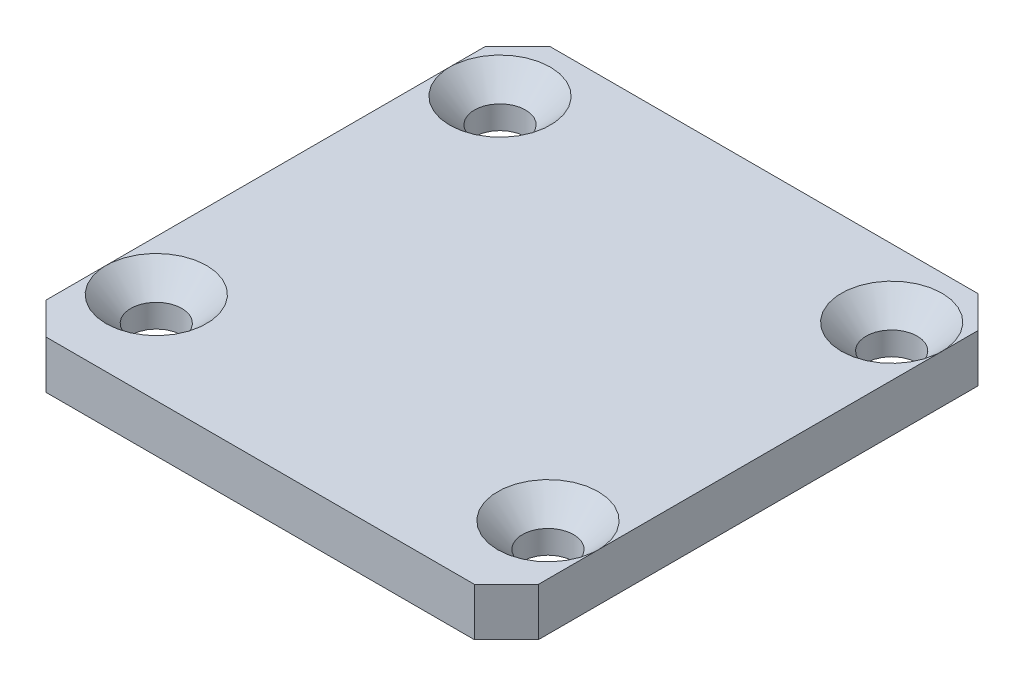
SolidWorks part; units mm, degrees
ref_plane "Front Plane" through (0, 0, 0) normal (0, 0, 1) x (1, 0, 0)
ref_plane "Top Plane" through (0, 0, 0) normal (0, 1, 0) x (1, 0, 0)
ref_plane "Right Plane" through (0, 0, 0) normal (1, 0, 0) x (0, 0, -1)
sketch "Sketch1" plane through (0, 0, 0) normal (0, 1, 0) x (1, 0, 0)
  line L1 (15.4, -15.75) -> (-15.4, -15.75)
  line L2 (15.4, -15.75) -> (15.4, 15.75)
  line L3 (15.4, 15.75) -> (-15.4, 15.75)
  line L4 (-15.4, -15.75) -> (-15.4, 15.75)
  line L5 (15.4, -15.75) -> (-15.4, 15.75) construction
  line L6 (15.4, 15.75) -> (-15.4, -15.75) construction
  point P0 (0, 0)
  dimension "D1" = 30.8
  dimension "D2" = 31.5
extrude "Boss-Extrude1" add sketch "Sketch1" along normal blind 3
chamfer "Chamfer1" distance 2 angle 45 4 edges at (-15.4, 1.5, -15.75) (15.4, 1.5, -15.75) (15.4, 1.5, 15.75) (-15.4, 1.5, 15.75)
hole_wizard "CSK for M3 Flat Head Machine Screw1" positions "Sketch11" profile "Sketch10" countersink size "M3" standard "ANSI Metric"
sketch "Sketch11" plane through (16.1594, 3, 3.7896) normal (0, 1, 0) x (-1, 0, 0)
  line L0 (16.1594, -1.7111) -> (16.1594, -5.8681) construction
  line L1 (18.2378, -3.7896) -> (14.0809, -3.7896) construction
  point P0 (28.4094, 6.2104)
  dimension "D1" = 12.25
  dimension "D2" = 10
sketch "Sketch10" plane through (-12.25, 3, 10) normal (1, 0, 0) x (0, 0, 1)
  line L0 (0, 0) -> (0, 3)
  line L1 (0, 3) -> (1.6, 3)
  line L2 (1.6, 3) -> (1.6, 1.55)
  line L3 (1.6, 1.55) -> (3.15, 0)
  line L5 (3.15, 0) -> (0, 0)
  line L6 (-1.6, 1.55) -> (-3.15, 0) construction
  line L11 (0, -6.35) -> (0, 107.95) construction
  dimension "Thru Hole Dia." = 3.2
  dimension "Thru Hole Depth" = 3
  dimension "Near C'Sink Dia." = 6.3
  dimension "Near C'Sink Angle" = 90
pattern_linear "LPattern1" count 2 spacing 24.5 along (1, 0, 0) count 2 spacing 21.5 along (0, 0, -1) of "CSK for M3 Flat Head Machine Screw1"
sketch "Sketch12" plane through (0, 0, 0) normal (0, -1, 0) x (1, 0, 0)
  line L2 (13.4, -15.75) -> (-13.4, -15.75) construction
  line L3 (15.4, 13.75) -> (15.4, -13.75) construction
  circle A0 centre (0.5, -0.75) radius 13.375 construction
  circle A1 centre (0.5, -0.75) radius 12.954
  circle A2 centre (0.5, -0.75) radius 14.097
  arc A4 (-11.6453, 3.7553) -> (-12.4199, 0.1899) centre (-12.1587, 2) ccw
  arc A6 (-12.4455, 4.8303) -> (-13.5939, -0.4562) centre (-12.1587, 2) ccw
  point P14 (-3.0682, 0.6314)
  point P15 (-4.2402, -4.7292)
  dimension "D1" = 26.75
  dimension "D4" = 25.908
  dimension "D5" = 1.143
  dimension "D7" = 1.8288
  dimension "D8" = 1.016
  dimension "D2" = 15
  dimension "D3" = 14.9
  dimension "D6" = 17.75
extrude "Cut-Extrude1" cut sketch "Sketch12" against normal blind 0.7112 contours A2 A6 A4 | A4 A1 A2
fillet "Fillet1" radius 30 4 edges at (-12.4455, 0.3556, 4.8303) (-13.5939, 0.3556, -0.4562) (-11.6453, 0.3556, 3.7553) (-12.4199, 0.3556, 0.1899)
sketch "Sketch13" plane through (0, 0, 0) normal (0, 0, 1) x (1, 0, 0)
  line L0 (16.4248, 1.8041) -> (16.2991, 2.0865) construction
  line L1 (16.4847, 2.3723) -> (17.3624, 2.3723) construction
  line L2 (17.548, 2.0865) -> (17.4223, 1.8041) construction
  line L3 (16.332, 1.6611) -> (16.2825, 1.6611) construction
  line L4 (17.5151, 1.6611) -> (17.9262, 1.6611) construction
  line L5 (16.332, 1.6611) -> (16.4885, 1.6611) construction
  line L6 (16.4885, 1.6611) -> (16.4248, 1.8041) construction
  line L7 (17.5151, 1.6611) -> (17.3586, 1.6611) construction
  line L8 (17.3586, 1.6611) -> (17.4223, 1.8041) construction
  line L9 (13.4323, 0.7112) -> (14.8937, 0.7112) construction
  line L10 (13.4323, 0) -> (13.2429, 0.4254)
  line L11 (13.4285, 0.7112) -> (13.4323, 0.7112)
  line L12 (13.4323, 0) -> (13.6684, 0)
  line L13 (-12.0803, 0) -> (13.454, 0) construction
  line L14 (13.4323, 0) -> (13.4323, 0.7112) construction
  line L17 (14.577, 0) -> (14.8937, 0.7112) construction
  line L18 (13.6684, 0) -> (13.6684, 0.7112)
  line L19 (13.4323, 0) -> (14.577, 0) construction
  line L20 (16.2815, 1.8723) -> (16.2815, 2.3322) construction
  line L21 (16.4885, 1.6611) -> (17.3586, 1.6611) construction
  line L22 (13.6684, 0.7112) -> (13.4323, 0.7112)
  line L23 (-12.0803, 0.7112) -> (13.454, 0.7112) construction
  arc A0 (17.3624, 2.3723) -> (17.548, 2.0865) centre (17.3624, 2.1691) cw construction
  arc A1 (16.2991, 2.0865) -> (16.4847, 2.3723) centre (16.4847, 2.1691) cw construction
  circle A2 centre (16.9235, 1.8723) radius 0.5 construction
  arc A3 (17.4223, 1.8041) -> (17.5151, 1.6611) centre (17.5151, 1.7627) ccw construction
  arc A4 (16.4248, 1.8041) -> (16.332, 1.6611) centre (16.332, 1.7627) cw construction
  circle A5 centre (13.8648, 0.2112) radius 0.5 construction
  arc A6 (13.2429, 0.4254) -> (13.4285, 0.7112) centre (13.4285, 0.508) cw
  point P12 (16.9235, 2.3723)
  point P14 (17.3586, 1.6611)
  point P15 (17.3586, 1.6611)
  point P18 (16.4885, 1.6611)
  point P20 (16.4885, 1.6611)
  dimension "D4" = 0.2032
  dimension "D5" = 1
  dimension "D3" = 48
  dimension "D6" = 0.1016
  dimension "D7" = 1
  dimension "D8" = 0.2032
  dimension "D1" = 48
  dimension "D2" = 0.7112
  dimension "D9" = 13.8648
  dimension "D10" = 0.2361
  dimension "D11" = 0.2398
sketch "Sketch14" plane through (0, 0, 0) normal (0, -1, 0) x (1, 0, 0)
  arc A25 (-12.8244, -3.817) -> (-10.3509, 7.5689) centre (0.5, -0.75) ccw
  arc A26 (-12.8244, -3.817) -> (-14.3929, 1.0683) centre (-42.4733, -10.6416) ccw
  arc A27 (-13.805, 3.7746) -> (-14.3929, 1.0683) centre (-12.1587, 2) ccw
  arc A28 (-13.805, 3.7746) -> (-10.3509, 7.5689) centre (-34.4959, 26.0797) ccw
  arc A29 (-12.8244, -3.817) -> (-10.3509, 7.5689) centre (0.5, -0.75) ccw
  arc A30 (-12.8244, -3.817) -> (-14.3929, 1.0683) centre (-42.4733, -10.6416) ccw
  arc A31 (-13.805, 3.7746) -> (-14.3929, 1.0683) centre (-12.1587, 2) ccw
  arc A32 (-13.805, 3.7746) -> (-10.3509, 7.5689) centre (-34.4959, 26.0797) ccw
  dimension "D1" = 0.4242
sweep "Cut-Sweep1" cut profiles "Sketch13" path "Sketch14"
fillet "Fillet2" radius 0.1016 5 edges at (-11.4928, 0, 5.0857) (-13.8301, 0, 2.3227) (-12.8089, 0, -1.1591)
sketch "Sketch15" plane through (0, 0, 0) normal (0, -1, 0) x (1, 0, 0)
  line L1 (13.4, -15.75) -> (-13.4, -15.75) construction
  line L2 (15.4, 13.75) -> (15.4, -13.75) construction
  circle A0 centre (-12.2, 5.85) radius 0.889
  dimension "D1" = 1.778
  dimension "D2" = 21.6
  dimension "D3" = 27.6
extrude "Cut-Extrude2" cut sketch "Sketch15" against normal up to surface (0.7112 mm away)
fillet "Fillet3" radius 2.54 2 edges at (-11.6958, 0.3556, 6.5822) (-12.8798, 0.3556, 5.2772)
